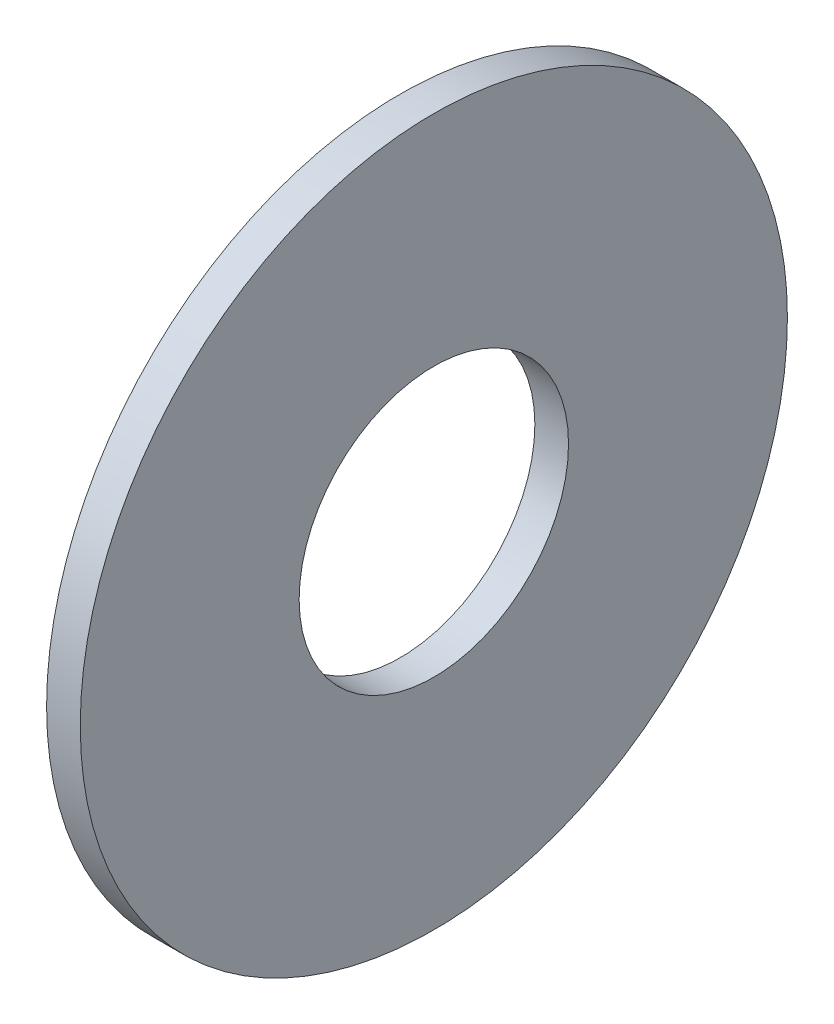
SolidWorks part; units mm, degrees
ref_plane "Plan de face" through (0, 0, 0) normal (0, 0, 1) x (1, 0, 0)
ref_plane "Plan de dessus" through (0, 0, 0) normal (0, 1, 0) x (1, 0, 0)
ref_plane "Plan de droite" through (0, 0, 0) normal (1, 0, 0) x (0, 0, -1)
sketch "Esquisse1" plane through (0, 0, 0) normal (1, 0, 0) x (0, 0, -1)
  circle A0 centre (0, 0) radius 10.5
  circle A1 centre (0, 0) radius 4
  dimension "D1" = 8
  dimension "D2" = 21
extrude "Extrusion1" add sketch "Esquisse1" along normal blind 1
